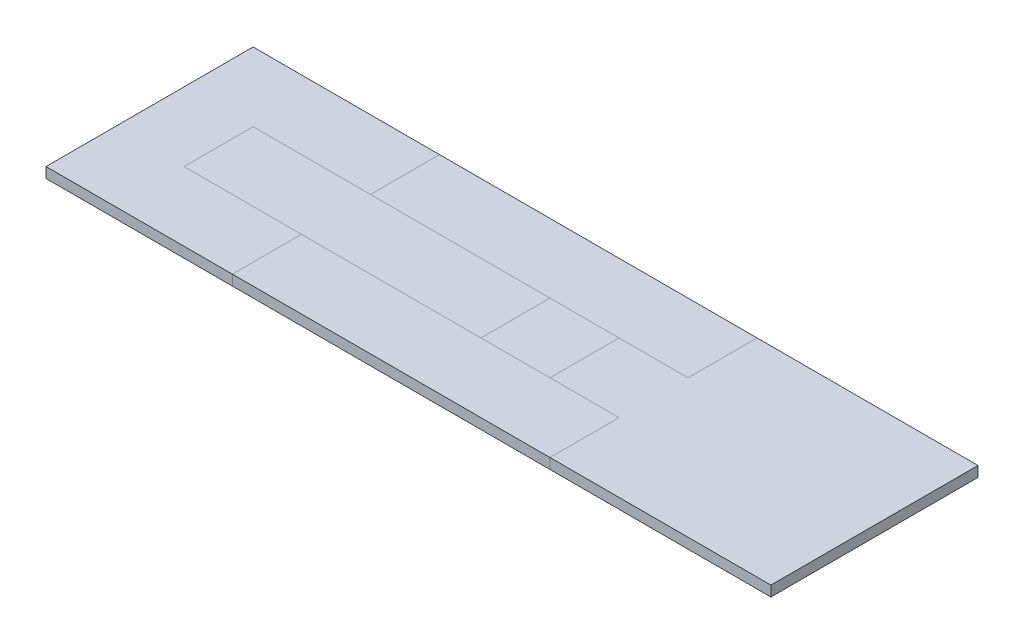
SolidWorks part; units mm, degrees
ref_plane "Front Plane" through (0, 0, 0) normal (0, 0, 1) x (1, 0, 0)
ref_plane "Top Plane" through (0, 0, 0) normal (0, 1, 0) x (1, 0, 0)
ref_plane "Right Plane" through (0, 0, 0) normal (1, 0, 0) x (0, 0, -1)
sketch "Sketch1" plane through (0, 0, 0) normal (0, 1, 0) x (1, 0, 0)
  line L8 (31.5, 5) -> (31.5, -5)
  line L9 (-21.5, -5) -> (-4.5, -5)
  line L10 (-21.5, -5) -> (-21.5, 5)
  line L11 (-21.5, 5) -> (-4.5, 5)
  line L12 (21.5, -5) -> (21.5, 5)
  line L13 (-21.5, -5) -> (21.5, 5) construction
  line L14 (-21.5, 5) -> (21.5, -5) construction
  line L15 (41.5, 15) -> (73.5, 15)
  line L16 (-31.5, 15) -> (-31.5, -15)
  line L17 (73.5, 15) -> (73.5, -15)
  line L18 (73.5, -15) -> (41.5, -15)
  line L19 (-31.5, 15) -> (-4.5, 15)
  line L20 (-4.5, 15) -> (-4.5, 5)
  line L21 (-31.5, -15) -> (-4.5, -15)
  line L22 (-4.5, -15) -> (-4.5, -5)
  line L23 (-4.5, 15) -> (41.5, 15)
  line L24 (41.5, 15) -> (41.5, 5)
  line L25 (31.5, 5) -> (21.5, 5)
  line L26 (-4.5, -15) -> (41.5, -15)
  line L27 (41.5, -15) -> (41.5, -5)
  line L28 (31.5, -5) -> (21.5, -5)
  line L29 (31.5, 5) -> (41.5, 5)
  line L30 (31.5, -5) -> (41.5, -5)
  line L31 (-4.5, 5) -> (21.5, 5)
  line L32 (21.5, -5) -> (-4.5, -5)
  point P0 (0, 0)
  dimension "D1" = 17
  dimension "D2" = 46
  dimension "D3" = 10
  dimension "D4" = 10
  dimension "D5" = 10
  dimension "D6" = 10
  dimension "D7" = 10
  dimension "D8" = 32
extrude "Boss-Extrude1" add sketch "Sketch1" along normal blind 1.5 contours L21 L22 L9 L10 L11 L20 L19 L16 | L9 L12 L11 L10 | L27 L28 L9 L22 L26 | L25 L24 L23 L20 L11 | L28 L8 L25 L12 | L28 L27 L18 L17 L15 L24 L25 L8
sketch "Sketch2" plane through (0, 0, 0) normal (0, 1, 0) x (1, 0, 0)
  line L28 (-4.5, -15) -> (-4.5, -5) construction
  line L30 (-4.5, 15) -> (-4.5, 5) construction
  line L35 (41.5, 15) -> (41.5, 5) construction
  line L36 (31.5, 5) -> (41.5, 5) construction
  line L37 (21.5, -5) -> (21.5, 5) construction
  line L38 (31.5, 5) -> (21.5, 5) construction
  line L39 (-4.5, 5) -> (21.5, 5) construction
  line L40 (31.5, -5) -> (21.5, -5) construction
  line L41 (21.5, -5) -> (-4.5, -5) construction
  line L42 (-21.5, -5) -> (-4.5, -5) construction
  line L43 (-21.5, -5) -> (-21.5, 5) construction
  line L44 (-21.5, 5) -> (-4.5, 5) construction
  line L45 (41.5, -15) -> (41.5, -5) construction
  line L46 (31.5, -5) -> (41.5, -5) construction
  line L47 (31.5, 5) -> (31.5, -5) construction
  line L51 (-4.5, -15) -> (-4.5, -5)
  line L53 (-4.5, 15) -> (-4.5, 5)
  line L58 (41.5, 15) -> (41.5, 5)
  line L59 (31.5, 5) -> (41.5, 5)
  line L60 (21.5, -5) -> (21.5, 5)
  line L61 (31.5, 5) -> (21.5, 5)
  line L62 (-4.5, 5) -> (21.5, 5)
  line L63 (31.5, -5) -> (21.5, -5)
  line L64 (21.5, -5) -> (-4.5, -5)
  line L65 (-21.5, -5) -> (-4.5, -5)
  line L66 (-21.5, -5) -> (-21.5, 5)
  line L67 (-21.5, 5) -> (-4.5, 5)
  line L68 (41.5, -15) -> (41.5, -5)
  line L69 (31.5, -5) -> (41.5, -5)
  line L70 (31.5, 5) -> (31.5, -5)
split "Split1" trim tools "Sketch2" bodies to split 107 resulting bodies 108 109 110 111 112 113
